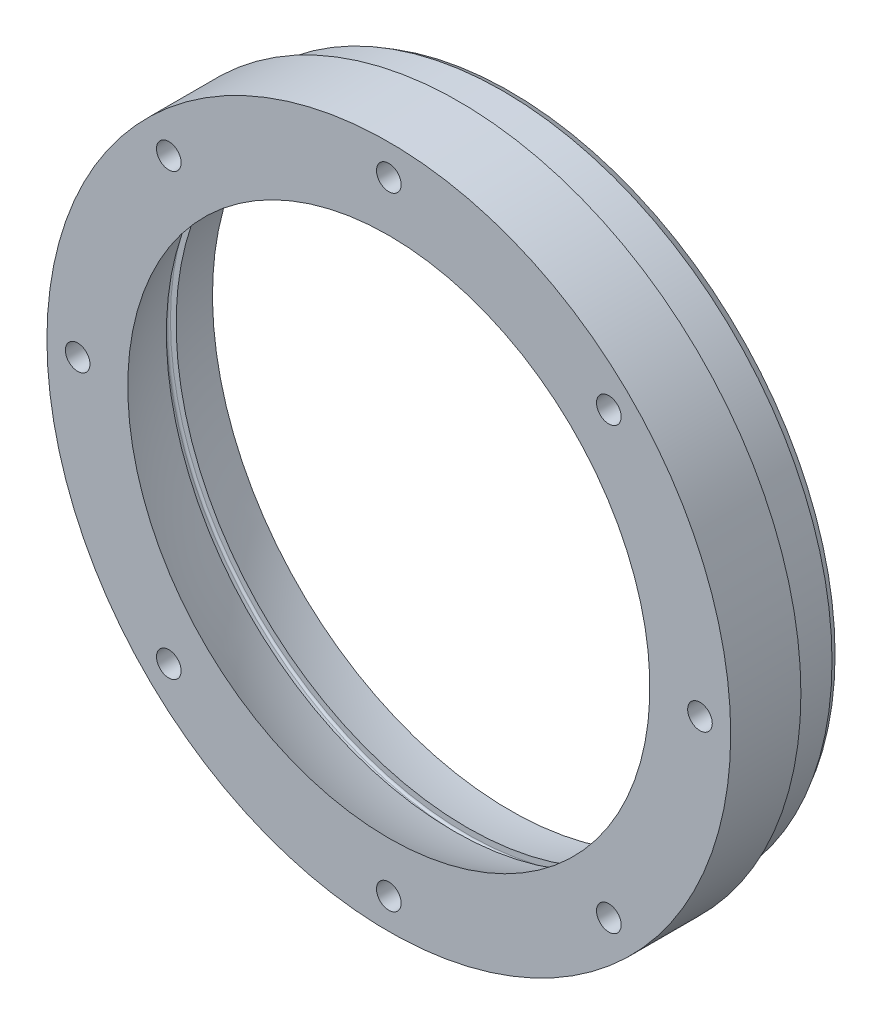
SolidWorks part; units mm, degrees
ref_plane "Plan de face" through (0, 0, 0) normal (0, 0, 1) x (1, 0, 0)
ref_plane "Plan de dessus" through (0, 0, 0) normal (0, 1, 0) x (1, 0, 0)
ref_plane "Plan de droite" through (0, 0, 0) normal (1, 0, 0) x (0, 0, -1)
sketch "Esquisse1" plane through (0, 0, 0) normal (1, 0, 0) x (0, 0, -1)
  line L0 (0, 0) -> (66.9811, 0) construction
  line L1 (0, 94.5) -> (19.4, 94.5)
  line L2 (19.4, 94.5) -> (19.4, 91)
  line L3 (19.4, 91) -> (31.5, 91)
  line L4 (33.5, 89.8453) -> (33.5, 82.2435)
  line L5 (0, 94.5) -> (0, 72.1543)
  line L6 (0, 94.5) -> (0, -64.2932) construction
  line L7 (31.5, 91) -> (33.5, 89.8453)
  arc A0 (33.5, 82.2435) -> (0, 72.1543) centre (40, 0) ccw
  point P7 (33.5, 91)
  dimension "D6" = 82.5
  dimension "D1" = 33.5
  dimension "D2" = 189
  dimension "D3" = 19.4
  dimension "D4" = 182
  dimension "D5" = 40
  dimension "D7" = 2
  dimension "D8" = 30
revolve "Révolution1" add sketch "Esquisse1" angle 360 about L0
sketch "Esquisse2" plane through (0, 0, 0) normal (0, 0, 1) x (1, 0, 0)
  line L0 (0, -35.75) -> (0, 106.7203) construction
  circle A0 centre (0, 0) radius 86 construction
  point P5 (0, 86)
  dimension "D1" = 172
hole_wizard "Trou taraudé M81" positions "Esquisse3D1" profile "Esquisse3" tap size "M8" standard "ISO"
sketch3d "Esquisse3D1"
  point P0 (0, 86, 0)
sketch "Esquisse3" plane through (0, 86, 0) normal (1, 0, 0) x (0, -1, 0)
  line L0 (0, 0) -> (0, 12.5429)
  line L1 (0, 12.5429) -> (3.4, 10.5)
  line L2 (3.4, 10.5) -> (3.4, 0)
  line L5 (3.4, 0) -> (0, 0)
  line L10 (0, 12.5429) -> (-3.4, 10.5) construction
  line L11 (0, -6.35) -> (0, 107.95) construction
  dimension "Diamètre du trou pour taraudage" = 6.8
  dimension "Profondeur du trou pour taraudage" = 10.5
  dimension "Angle de pointe" = 118
pattern_circular "Répétition circulaire1" count 8 over 360 about axis through (0, 0, 0) along (0, 0, 1) of "Trou taraudé M81"
ref_plane "Plan1" through (0, 0, -21.64) normal (0, 0, -1) x (-1, 0, 0)
sketch "Esquisse4" plane through (0, 0, -21.64) normal (0, 0, -1) x (-1, 0, 0)
  circle A0 centre (0, 0) radius 82.6
  circle A1 centre (0, 0) radius 64.3226
  dimension "D1" = 165.2
extrude "Extrusion1" cut sketch "Esquisse4" against normal blind 3.6
fillet "Congé1" radius 0.6 2 edges at (-82.6, 0, -21.64) (-82.6, 0, -18.04)
